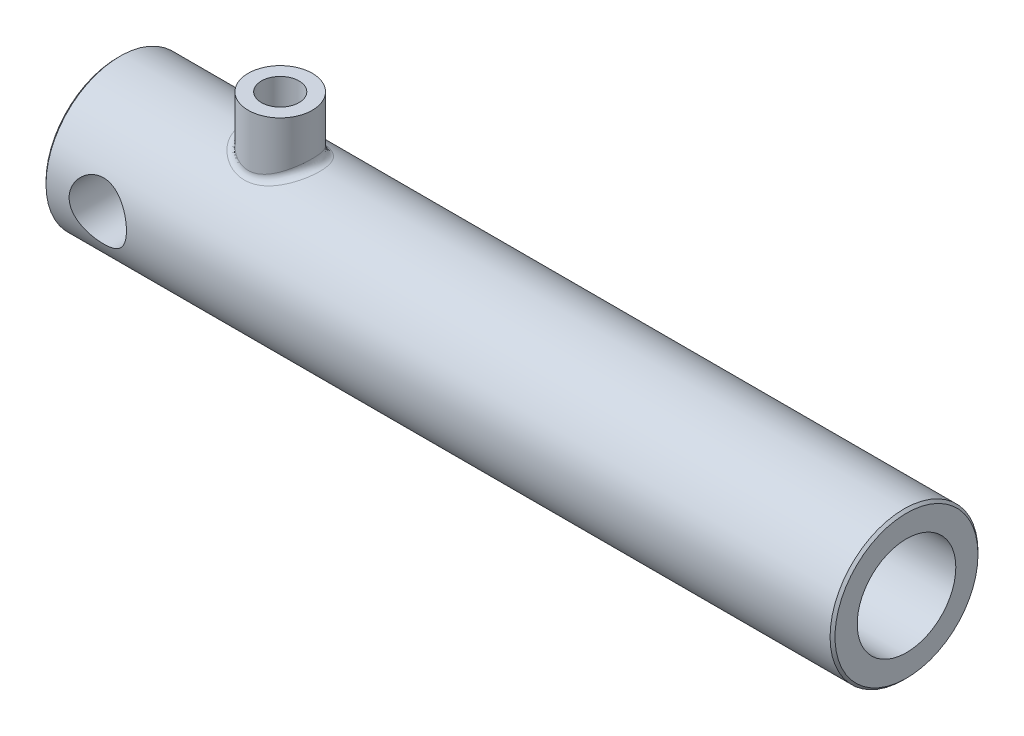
SolidWorks part; units mm, degrees
ref_plane "Plan de face" through (0, 0, 0) normal (0, 0, 1) x (1, 0, 0)
ref_plane "Plan de dessus" through (0, 0, 0) normal (0, 1, 0) x (1, 0, 0)
ref_plane "Plan de droite" through (0, 0, 0) normal (1, 0, 0) x (0, 0, -1)
ref_plane "Plan1" through (0, 0, 0) normal (0, 0, -1) x (-1, 0, 0)
sketch "Esquisse1" plane through (0, 0, 0) normal (0, 0, -1) x (-1, 0, 0)
  line L0 (-320, 30) -> (-320, 0)
  line L1 (-320, 0) -> (0, 0)
  line L2 (0, 0) -> (0, 30)
  line L3 (0, 30) -> (-320, 30)
  line L4 (-320, 0) -> (0, 0) construction
revolve "Révolution1" add sketch "Esquisse1" angle 360 about L4
ref_plane "Plan2" through (66, 0, 0) normal (1, 0, 0) x (0, 0, -1)
sketch "Esquisse2" plane through (66, 0, 0) normal (1, 0, 0) x (0, 0, -1)
  line L0 (13, 50) -> (0, 50)
  line L1 (0, 50) -> (0, 27.037)
  line L2 (0, 27.037) -> (13, 27.037)
  line L3 (13, 27.037) -> (13, 50)
  line L4 (0, 50) -> (0, 27.037) construction
revolve "Révolution2" add sketch "Esquisse2" angle 360 about L4
hole_wizard "Dégagement M201" positions "Esquisse3D1" profile "Esquisse3" hole size "M20" standard "Ansi Metric"
sketch3d "Esquisse3D1"
  point P0 (22, 0, -30)
sketch "Esquisse3" plane through (22, 0, -30) normal (1, 0, 0) x (0, 1, 0)
  line L0 (0, 0) -> (0, 60)
  line L1 (0, 60) -> (11.625, 60)
  line L2 (11.625, 60) -> (11.625, 0)
  line L5 (11.625, 0) -> (0, 0)
  line L11 (0, -6.35) -> (0, 107.95) construction
  dimension "Diamètre du perçage jusqu'au prochain" = 23.25
  dimension "Profondeur du perçage jusqu'au prochain" = 60
hole_wizard "Diamètre du perçage Ø6.8 (6.8)1" positions "Esquisse5" profile "Esquisse4" hole size "Ø6.8" standard "Ansi Metric"
sketch "Esquisse5" plane through (0, 0, 0) normal (-1, 0, 0) x (0, 0, 1)
  point P0 (0, 0)
sketch "Esquisse4" plane through (0, 0, 0) normal (0, 1, 0) x (0, 0, 1)
  line L0 (0, 0) -> (0, 10.375)
  line L1 (0, 10.375) -> (3.4, 10.375)
  line L2 (3.4, 10.375) -> (3.4, 0)
  line L5 (3.4, 0) -> (0, 0)
  line L11 (0, -6.35) -> (0, 107.95) construction
  dimension "Diamètre du perçage jusqu'au prochain" = 6.8
  dimension "Profondeur du perçage jusqu'au prochain" = 10.375
hole_wizard "Chambrage pour vis à tête hexagonale M481" positions "Esquisse7" profile "Esquisse6" counterbore size "M48" standard "Ansi Metric"
sketch "Esquisse7" plane through (320, 0, 0) normal (1, 0, 0) x (0, 0, -1)
  point P0 (0, 0)
sketch "Esquisse6" plane through (320, 0, 0) normal (0, 1, 0) x (0, 0, -1)
  line L0 (0, 0) -> (0, 272)
  line L1 (0, 272) -> (25, 272)
  line L2 (25, 272) -> (25, 59)
  line L3 (25, 59) -> (20, 59)
  line L4 (20, 59) -> (20, 0)
  line L5 (20, 0) -> (0, 0)
  line L10 (0, 272) -> (-25, 272) construction
  line L11 (0, -6.35) -> (0, 107.95) construction
  dimension "Diamètre du perçage" = 50
  dimension "Profondeur du perçage" = 272
  dimension "Diamètre du chambrage" = 40
  dimension "Profondeur du chambrage" = 59
  dimension "Angle de pointe" = 180
hole_wizard "Diamètre du perçage Ø15.25 (15.25)1" positions "Esquisse9" profile "Esquisse8" hole size "Ø15.25" standard "Ansi Metric"
sketch "Esquisse9" plane through (0, 50, 0) normal (0, 1, 0) x (1, 0, 0)
  point P0 (66, 0)
sketch "Esquisse8" plane through (66, 50, 0) normal (1, 0, 0) x (0, 0, 1)
  line L0 (0, 0) -> (0, 25)
  line L1 (0, 25) -> (7.625, 25)
  line L2 (7.625, 25) -> (7.625, 0)
  line L5 (7.625, 0) -> (0, 0)
  line L11 (0, -6.35) -> (0, 107.95) construction
  dimension "Diamètre du perçage jusqu'au prochain" = 15.25
  dimension "Profondeur du perçage jusqu'au prochain" = 25
chamfer "Chanfrein1" distance 1 angle 45 2 edges at (320, 0, 30) (0, 0, 30)
fillet "Congé1" radius 3 1 edges at (67.7452, 27.0933, 12.8823)
